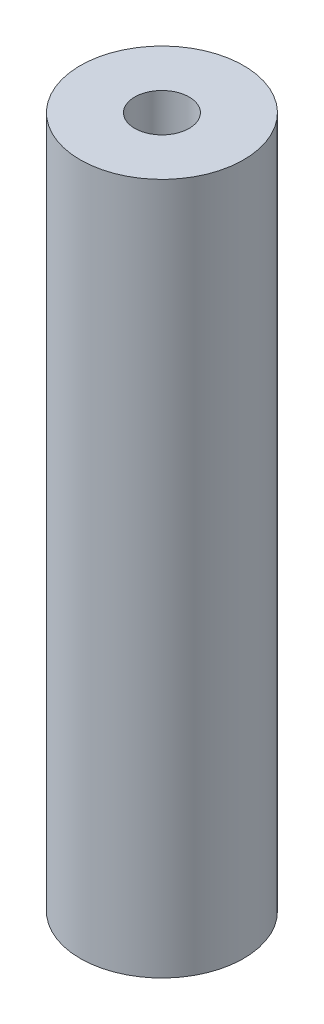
SolidWorks part; units mm, degrees
ref_plane "Plan de face" through (0, 0, 0) normal (0, 0, 1) x (1, 0, 0)
ref_plane "Plan de dessus" through (0, 0, 0) normal (0, 1, 0) x (1, 0, 0)
ref_plane "Plan de droite" through (0, 0, 0) normal (1, 0, 0) x (0, 0, -1)
sketch "Esquisse1" plane through (0, 0, 0) normal (0, 1, 0) x (1, 0, 0)
  circle A0 centre (0, 0) radius 5
  circle A1 centre (0, 0) radius 15
  dimension "D1" = 10
  dimension "D2" = 30
extrude "Boss.-Extru.1" add sketch "Esquisse1" along normal blind 127
